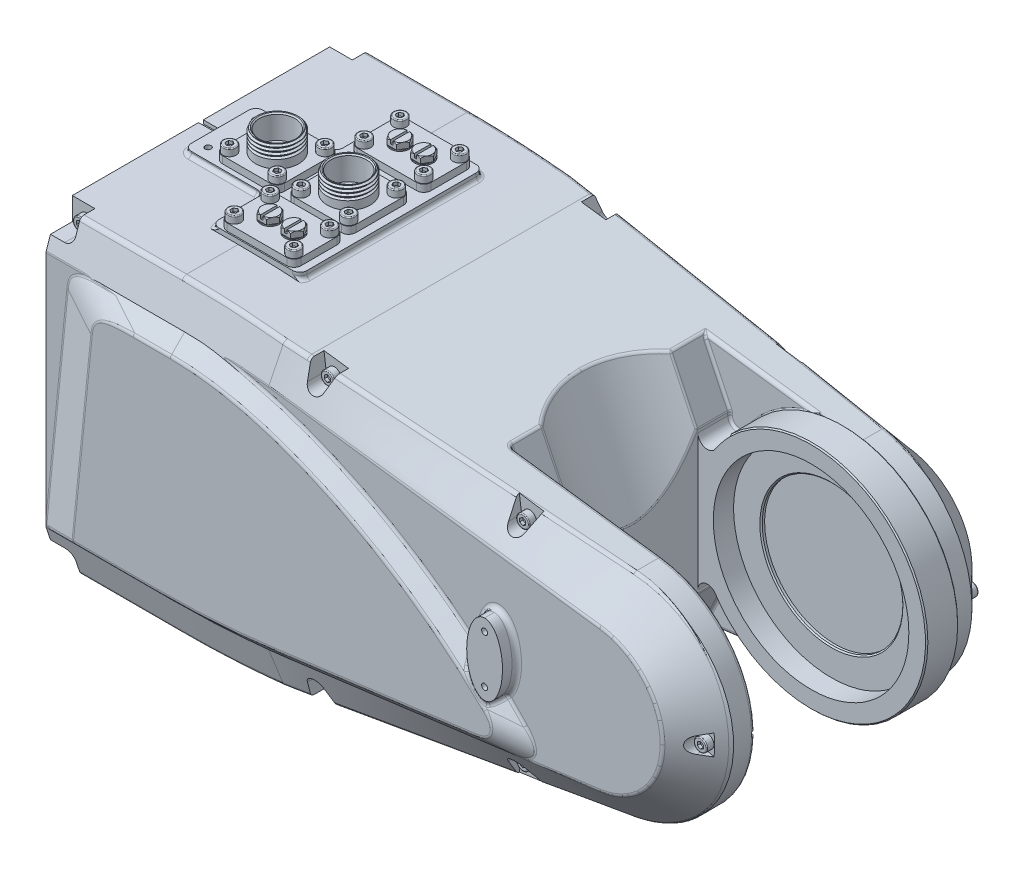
SolidWorks part; units mm, degrees
other "M3X8_GB 70.1-2000-29-solid1"
other "M3X8_GB 70.1-2000-26-solid1"
other "M3X8_GB 70.1-2000-50-solid1"
other "M3X8_GB 70.1-2000-30-solid1"
other "M3X8_GB 70.1-2000-18-solid1"
other "M3X8_GB 70.1-2000-15-solid1"
other "M3X8_GB 70.1-2000-49-solid1"
other "M3X8_GB 70.1-2000-25-solid1"
other "NONE"
other "M3X8_GB 70.1-2000-52-solid1"
other "M3X8_GB 70.1-2000-17-solid1"
other "M-5P-4-solid1"
other "M3X8_GB 70.1-2000-28-solid1"
other "M3X8_GB 70.1-2000-32-solid1"
other "RTM700-500.07-1-solid1"
other "M-5P-3-solid1"
other "M3X8_GB 70.1-2000-16-solid1"
other "M3X8_GB 70.1-2000-51-solid1"
other "M3X8_GB 70.1-2000-31-solid1"
other "RTM700-500.07-2-solid1"
other "M-5P-2-solid1"
other "M-5P-1-solid1"
other "M3X8_GB 70.1-2000-27-solid1"
ref_plane "前视基准面" through (0, 0, 0) normal (0, 0, 1) x (1, 0, 0)
ref_plane "上视基准面" through (0, 0, 0) normal (0, 1, 0) x (1, 0, 0)
ref_plane "右视基准面" through (0, 0, 0) normal (1, 0, 0) x (0, 0, -1)
imported_body "输入1"
imported_body "输入2"
imported_body "输入3"
imported_body "输入4"
imported_body "输入5"
imported_body "输入6"
imported_body "输入7"
imported_body "输入8"
imported_body "输入9"
imported_body "输入10"
imported_body "输入11"
imported_body "输入12"
imported_body "输入13"
imported_body "输入14"
imported_body "输入15"
imported_body "输入16"
imported_body "输入17"
imported_body "输入18"
imported_body "输入19"
imported_body "输入20"
imported_body "输入21"
imported_body "输入22"
imported_body "输入23"
split "分割1" bodies to split 114 resulting bodies 129
sketch "草图1" plane through (0, 0, 0) normal (-1, 0, 0) x (0, 0, 1)
  circle A1 centre (0, 0) radius 49.5
  circle A2 centre (0, 0) radius 49.5
  dimension "D1" = 0
extrude "切除-拉伸1" cut sketch "草图1" against normal blind 2
